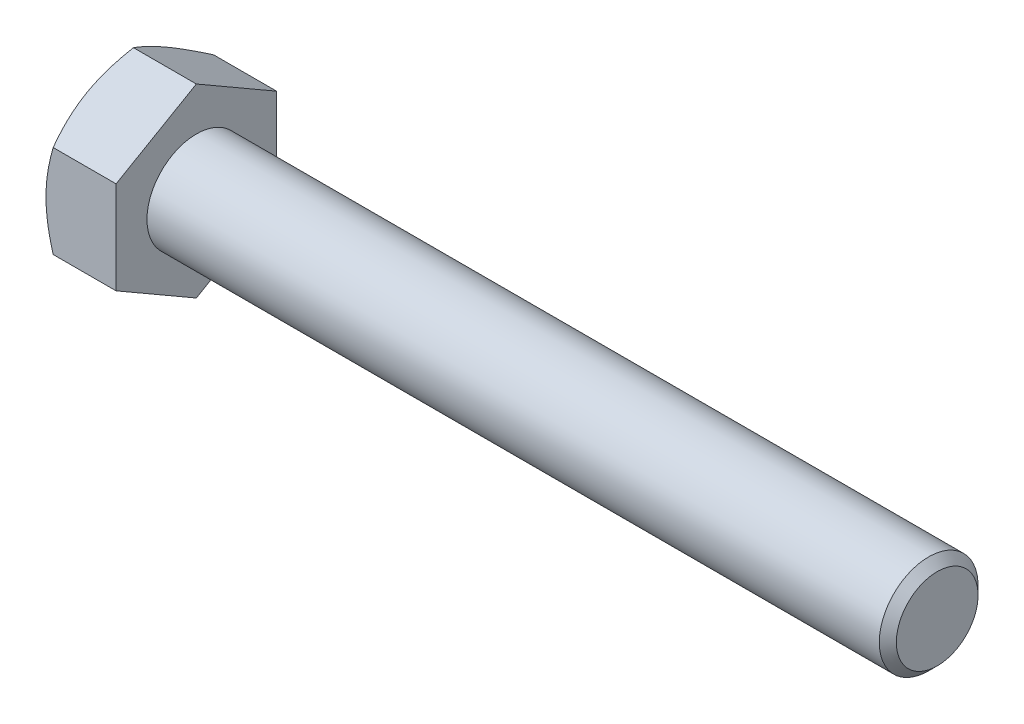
SolidWorks part; units mm, degrees
ref_plane "Plane1" through (0, 0, 0) normal (0, 0, 1) x (1, 0, 0)
ref_plane "Plane2" through (0, 0, 0) normal (0, 1, 0) x (1, 0, 0)
ref_plane "Plane3" through (0, 0, 0) normal (1, 0, 0) x (0, 0, -1)
extrude "BaseHead" add sketch "Sketch1" along normal blind 5.675
sketch "Sketch1" plane through (0, 0, 0) normal (1, 0, 0) x (0, 0, -1)
  line L0 (6.5, 3.7528) -> (6.5, -3.7528)
  line L1 (-6.5, 3.7528) -> (-6.5, -3.7528)
  line L2 (6.5, -3.7528) -> (0, -7.5056)
  line L3 (0, -7.5056) -> (-6.5, -3.7528)
  line L4 (6.5, 3.7528) -> (0, 7.5056)
  line L5 (0, 7.5056) -> (-6.5, 3.7528)
  dimension "Width_flats" = 13
  dimension "D2" = 120
  dimension "D3" = 6.5
  dimension "D4" = 6.5
  dimension "D5" = 6.5
revolve "BaseBody" add sketch "BodySke"
sketch "BodySke" plane through (0, 0, 0) normal (0, 0, 1) x (1, 0, 0)
  line L0 (0, 3.7528) -> (0, -3.7528) construction
  line L1 (0, 0) -> (65.675, 0)
  line L2 (0, 0) -> (0, 4)
  line L3 (0, 4) -> (64.9845, 4)
  line L4 (65.675, 0) -> (65.675, 3.3095)
  line L5 (5.675, 7.5056) -> (5.675, 3.7528) construction
  line L6 (65.675, 3.3095) -> (64.9845, 4)
  line L7 (0, 0) -> (96.52, 0) construction
  line L8 (65.675, -3.3095) -> (64.9845, -4) construction
  line L9 (0, -4) -> (64.9845, -4) construction
  line L10 (6.925, 15.24) -> (6.925, -1.27) construction
  line L12 (5.675, 3.7528) -> (5.675, -3.7528) construction
  dimension "Length" = 60
  dimension "Body_ch_ang" = 45
  dimension "Diameter" = 8
  dimension "Minor_dia" = 6.619
  dimension "Advance" = 1.25
fillet "HeadFillet" [suppressed] radius 0.4
sketch "Sketch3" plane through (0, 0, 0) normal (0, 0, 1) x (1, 0, 0)
  line L0 (0, 6.5) -> (3.4673, 12.5056)
  line L1 (0, 7.5056) -> (0, 3.7528) construction
  line L2 (3.4673, 12.5056) -> (3.4673, 17.5056)
  line L3 (3.4673, 17.5056) -> (-10, 17.5056)
  line L4 (-10, 17.5056) -> (-10, 6.5)
  line L5 (-10, 6.5) -> (0, 6.5)
  line L6 (0, 0) -> (99.06, 0) construction
  line L7 (5.675, 7.5056) -> (0, 7.5056) construction
  dimension "D1" = 6.5
  dimension "D2" = 5
  dimension "D3" = 10
  dimension "D4" = 5
  dimension "Head_ch_ang" = 30
revolve "HeadChamfer" cut sketch "Sketch3" angle 360 about L6
sketch "Sketch4" plane through (0, 0, 0) normal (0, 0, 1) x (1, 0, 0)
  line L1 (5.675, 7.5056) -> (5.675, 3.7528) construction
  line L2 (5.675, 6.5) -> (5.075, 6.5)
  line L3 (5.675, 6.5) -> (5.675, 17.5056)
  line L4 (5.675, 17.5056) -> (5.075, 17.5056)
  line L5 (0, 0) -> (95.25, 0) construction
  line L6 (0, 0) -> (96.52, 0) construction
  line L7 (5.075, 6.5) -> (5.075, 17.5056)
  line L8 (5.675, 7.5056) -> (0.5806, 7.5056) construction
  dimension "D1" = 13
  dimension "D2" = 10
  dimension "Bearing_ht" = 0.6
revolve "BearingFace" [suppressed] cut sketch "Sketch4" angle 360 about L5
sketch "ThdSchSke" plane through (0, 0, 0) normal (0, 0, 1) x (1, 0, 0)
  line L0 (6.925, -3.3095) -> (6.4415, -4)
  line L1 (6.925, -3.3095) -> (7.4085, -4)
  line L2 (7.4085, -4) -> (7.4085, -5)
  line L3 (-3.175, 0) -> (5.1513, 0) construction
  line L5 (7.4085, -5) -> (6.4415, -5)
  line L6 (6.4415, -5) -> (6.4415, -4)
  dimension "Thread_minor" = 6.619
  dimension "Diameter" = 8
  dimension "Start" = 6.925
  dimension "SideAngle" = 55
  dimension "VeeAngle" = 70
  dimension "Overcut" = 10
revolve "ThreadSchematic" [suppressed] cut sketch "ThdSchSke" angle 360 about L3
pattern_linear "ThdSchPat" [suppressed]
equation "\"D3@Sketch1\" = \"Width_flats@Sketch1\" / 2"
equation "\"D4@Sketch1\" = \"D3@Sketch1\""
equation "\"D5@Sketch1\" = \"D4@Sketch1\""
equation "\"Thread_minor@ThreadCosmetic\" = \"Minor_dia@BodySke\""
equation "\"D1@Sketch3\" = \"Width_flats@Sketch1\" / 2"
equation "\"D1@Sketch4\" = \"Width_flats@Sketch1\""
equation "\"Thread_length@ThreadCosmetic\" = \"Length@BodySke\" - \"Advance@BodySke\""
equation "\"Thread_minor@ThdSchSke\" = \"Minor_dia@BodySke\""
equation "\"Diameter@ThdSchSke\" = \"Diameter@BodySke\""
equation "\"Overcut@ThdSchSke\" = \"Diameter@BodySke\" * 1.25"
equation "\"Start@ThdSchSke\" = \"Head_ht@BaseHead\" + \"Length@BodySke\" - \"Thread_length@ThreadCosmetic\"  '---Non-countersunk---"
equation "\"Num_threads@ThdSchPat\" = int( \"Thread_length@ThreadCosmetic\" / \"Advance@BodySke\" + 0.999 )  + 1"
equation "\"Advance@ThdSchPat\" = \"Thread_length@ThreadCosmetic\" /  (\"Num_threads@ThdSchPat\" - 1) 'relax it"
equation "\"Num_threads@ThdSchPat\" = \"Num_threads@ThdSchPat\" - sgn( \"Num_threads@ThdSchPat\" - 1) '---chamfered tips only---"
